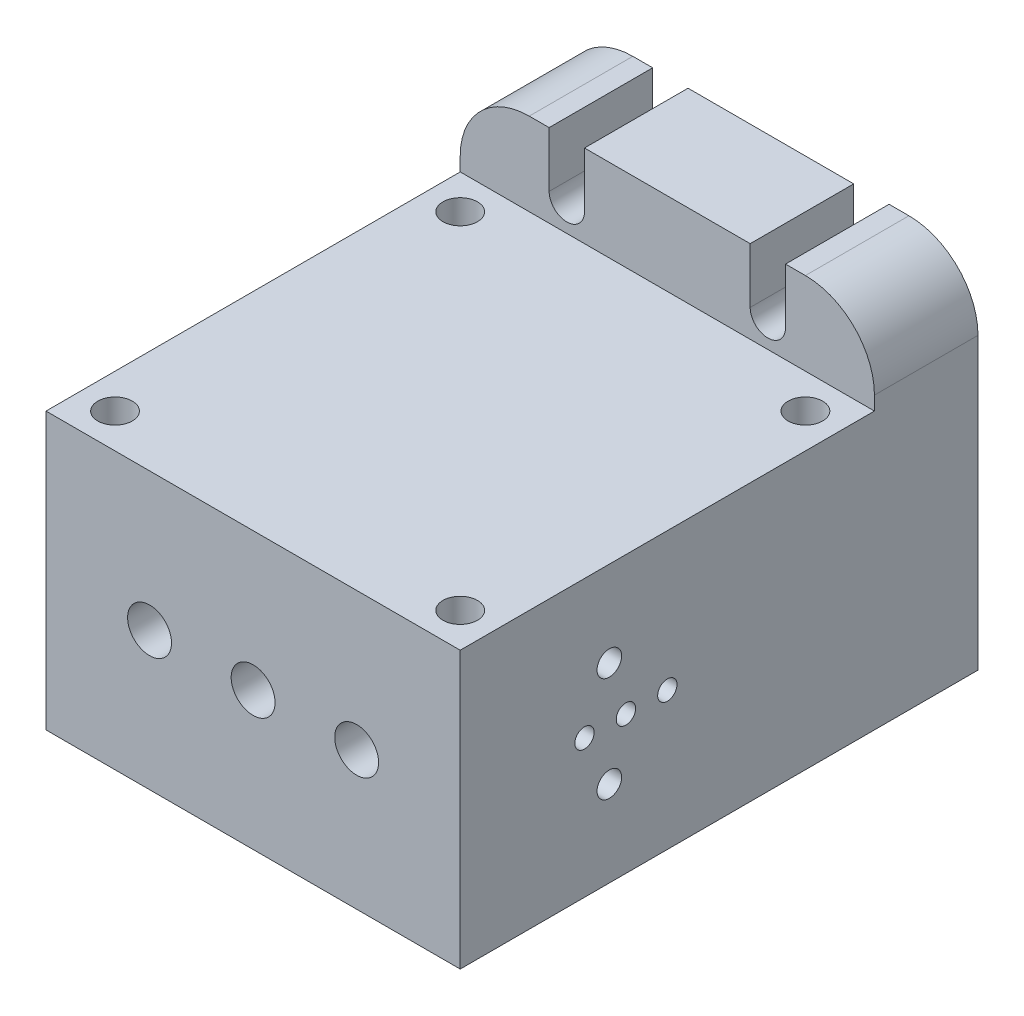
SolidWorks part; units mm, degrees
ref_plane "Front Plane" through (0, 0, 0) normal (0, 0, 1) x (1, 0, 0)
ref_plane "Top Plane" through (0, 0, 0) normal (0, 1, 0) x (1, 0, 0)
ref_plane "Right Plane" through (0, 0, 0) normal (1, 0, 0) x (0, 0, -1)
sketch "Sketch1" plane through (0, 0, 0) normal (0, 1, 0) x (1, 0, 0)
  line L1 (19.05, -19.05) -> (-19.05, -19.05)
  line L2 (19.05, -19.05) -> (19.05, 19.05)
  line L3 (19.05, 19.05) -> (-19.05, 19.05)
  line L4 (-19.05, -19.05) -> (-19.05, 19.05)
  line L5 (19.05, -19.05) -> (-19.05, 19.05) construction
  line L6 (19.05, 19.05) -> (-19.05, -19.05) construction
  point P0 (0, 0)
extrude "Boss-Extrude1" add sketch "Sketch1" along normal blind 25.4
sketch "Sketch43" plane through (0, 0, -19.05) normal (0, 0, -1) x (-1, 0, 0)
  line L0 (-19.05, 0) -> (19.05, 0) construction
  line L1 (19.05, 0) -> (-19.05, 0)
  line L2 (19.05, 0) -> (19.05, 25.4)
  line L3 (-19.05, 33.02) -> (19.05, 33.02)
  line L4 (-19.05, 0) -> (-19.05, 25.4)
  line L5 (19.05, 33.02) -> (19.05, 25.4)
  line L6 (-19.05, 33.02) -> (-19.05, 25.4)
  dimension "D1" = 38.1
  dimension "D2" = 7.62
hole_wizard "#50 (0.07) Diameter Hole1" positions "Sketch3" profile "Sketch2" hole size "#50" standard "Ansi Inch"
sketch "Sketch3" plane through (19.05, 0, 0) normal (1, 0, 0) x (0, 0, -1)
  point P0 (-3.81, 12.7)
sketch "Sketch2" plane through (19.05, 12.7, 3.81) normal (0, 1, 0) x (0, 0, -1)
  line L0 (0, 0) -> (0, 20.0922)
  line L1 (0, 20.0922) -> (0.889, 19.558)
  line L2 (0.889, 19.558) -> (0.889, 0)
  line L5 (0.889, 0) -> (0, 0)
  line L10 (0, 20.0922) -> (-0.889, 19.558) construction
  line L11 (0, -6.35) -> (0, 107.95) construction
  dimension "Hole Dia." = 1.778
  dimension "Hole Depth" = 19.558
  dimension "Drill Angle" = 118
hole_wizard "#50 (0.07) Diameter Hole2" positions "Sketch5" profile "Sketch4" hole size "#50" standard "Ansi Inch"
sketch "Sketch5" plane through (19.05, 0, 0) normal (1, 0, 0) x (0, 0, -1)
  point P0 (-7.62, 12.7)
sketch "Sketch4" plane through (19.05, 12.7, 7.62) normal (0, 1, 0) x (0, 0, -1)
  line L0 (0, 0) -> (0, 10.4402)
  line L1 (0, 10.4402) -> (0.889, 9.906)
  line L2 (0.889, 9.906) -> (0.889, 0)
  line L5 (0.889, 0) -> (0, 0)
  line L10 (0, 10.4402) -> (-0.889, 9.906) construction
  line L11 (0, -6.35) -> (0, 107.95) construction
  dimension "Hole Dia." = 1.778
  dimension "Hole Depth" = 9.906
  dimension "Drill Angle" = 118
hole_wizard "#50 (0.07) Diameter Hole3" positions "Sketch7" profile "Sketch6" hole size "#50" standard "Ansi Inch"
sketch "Sketch7" plane through (19.05, 0, 0) normal (1, 0, 0) x (0, 0, -1)
  point P0 (0, 12.7)
sketch "Sketch6" plane through (19.05, 12.7, 0) normal (0, 1, 0) x (0, 0, -1)
  line L0 (0, 0) -> (0, 38.1)
  line L1 (0, 38.1) -> (0.889, 38.1)
  line L2 (0.889, 38.1) -> (0.889, 0)
  line L5 (0.889, 0) -> (0, 0)
  line L11 (0, -6.35) -> (0, 107.95) construction
  dimension "Thru Hole Dia." = 1.778
  dimension "Thru Hole Depth" = 38.1
hole_wizard "#4-40 Tapped Hole1" positions "Sketch9" profile "Sketch8" tap size "#4-40" standard "Ansi Inch"
sketch "Sketch9" plane through (19.05, 0, 0) normal (1, 0, 0) x (0, 0, -1)
  point P0 (-5.334, 7.874)
sketch "Sketch8" plane through (19.05, 7.874, 5.334) normal (0, 1, 0) x (0, 0, -1)
  line L0 (0, 0) -> (0, 9.5692)
  line L1 (0, 9.5692) -> (1.1303, 8.89)
  line L2 (1.1303, 8.89) -> (1.1303, 0)
  line L5 (1.1303, 0) -> (0, 0)
  line L10 (0, 9.5692) -> (-1.1303, 8.89) construction
  line L11 (0, -6.35) -> (0, 107.95) construction
  dimension "Tap Drill Dia." = 2.2606
  dimension "Tap Drill Depth" = 8.89
  dimension "Drill Angle" = 118
hole_wizard "#4-40 Tapped Hole2" positions "Sketch11" profile "Sketch10" tap size "#4-40" standard "Ansi Inch"
sketch "Sketch11" plane through (19.05, 0, 0) normal (1, 0, 0) x (0, 0, -1)
  point P0 (-5.334, 17.526)
sketch "Sketch10" plane through (19.05, 17.526, 5.334) normal (0, 1, 0) x (0, 0, -1)
  line L0 (0, 0) -> (0, 9.5692)
  line L1 (0, 9.5692) -> (1.1303, 8.89)
  line L2 (1.1303, 8.89) -> (1.1303, 0)
  line L5 (1.1303, 0) -> (0, 0)
  line L10 (0, 9.5692) -> (-1.1303, 8.89) construction
  line L11 (0, -6.35) -> (0, 107.95) construction
  dimension "Tap Drill Dia." = 2.2606
  dimension "Tap Drill Depth" = 8.89
  dimension "Drill Angle" = 118
hole_wizard "#50 (0.07) Diameter Hole4" positions "Sketch13" profile "Sketch12" hole size "#50" standard "Ansi Inch"
sketch "Sketch13" plane through (0, 0, 19.05) normal (0, 0, 1) x (1, 0, 0)
  point P0 (9.525, 12.7)
sketch "Sketch12" plane through (9.525, 12.7, 19.05) normal (1, 0, 0) x (0, -1, 0)
  line L0 (0, 0) -> (0, 12.4722)
  line L1 (0, 12.4722) -> (0.889, 11.938)
  line L2 (0.889, 11.938) -> (0.889, 0)
  line L5 (0.889, 0) -> (0, 0)
  line L10 (0, 12.4722) -> (-0.889, 11.938) construction
  line L11 (0, -6.35) -> (0, 107.95) construction
  dimension "Hole Dia." = 1.778
  dimension "Hole Depth" = 11.938
  dimension "Drill Angle" = 118
hole_wizard "#50 (0.07) Diameter Hole5" positions "Sketch15" profile "Sketch14" hole size "#50" standard "Ansi Inch"
sketch "Sketch15" plane through (0, 0, 19.05) normal (0, 0, 1) x (1, 0, 0)
  point P0 (0, 12.7)
sketch "Sketch14" plane through (0, 12.7, 19.05) normal (1, 0, 0) x (0, -1, 0)
  line L0 (0, 0) -> (0, 16.2822)
  line L1 (0, 16.2822) -> (0.889, 15.748)
  line L2 (0.889, 15.748) -> (0.889, 0)
  line L5 (0.889, 0) -> (0, 0)
  line L10 (0, 16.2822) -> (-0.889, 15.748) construction
  line L11 (0, -6.35) -> (0, 107.95) construction
  dimension "Hole Dia." = 1.778
  dimension "Hole Depth" = 15.748
  dimension "Drill Angle" = 118
hole_wizard "#50 (0.07) Diameter Hole6" positions "Sketch17" profile "Sketch16" hole size "#50" standard "Ansi Inch"
sketch "Sketch17" plane through (-19.05, 0, 0) normal (-1, 0, 0) x (0, 0, 1)
  point P0 (3.81, 12.7)
sketch "Sketch16" plane through (-19.05, 12.7, 3.81) normal (0, 1, 0) x (0, 0, 1)
  line L0 (0, 0) -> (0, 10.6942)
  line L1 (0, 10.6942) -> (0.889, 10.16)
  line L2 (0.889, 10.16) -> (0.889, 0)
  line L5 (0.889, 0) -> (0, 0)
  line L10 (0, 10.6942) -> (-0.889, 10.16) construction
  line L11 (0, -6.35) -> (0, 107.95) construction
  dimension "Hole Dia." = 1.778
  dimension "Hole Depth" = 10.16
  dimension "Drill Angle" = 118
hole_wizard "#50 (0.07) Diameter Hole7" positions "Sketch19" profile "Sketch18" hole size "#50" standard "Ansi Inch"
sketch "Sketch19" plane through (0, 0, 19.05) normal (0, 0, 1) x (1, 0, 0)
  point P0 (-9.525, 12.7)
sketch "Sketch18" plane through (-9.525, 12.7, 19.05) normal (1, 0, 0) x (0, -1, 0)
  line L0 (0, 0) -> (0, 16.2822)
  line L1 (0, 16.2822) -> (0.889, 15.748)
  line L2 (0.889, 15.748) -> (0.889, 0)
  line L5 (0.889, 0) -> (0, 0)
  line L10 (0, 16.2822) -> (-0.889, 15.748) construction
  line L11 (0, -6.35) -> (0, 107.95) construction
  dimension "Hole Dia." = 1.778
  dimension "Hole Depth" = 15.748
  dimension "Drill Angle" = 118
hole_wizard "#50 (0.07) Diameter Hole8" positions "Sketch21" profile "Sketch20" hole size "#50" standard "Ansi Inch"
sketch "Sketch21" plane through (-19.05, 0, 0) normal (-1, 0, 0) x (0, 0, 1)
  point P0 (-3.81, 12.7)
sketch "Sketch20" plane through (-19.05, 12.7, -3.81) normal (0, 1, 0) x (0, 0, 1)
  line L0 (0, 0) -> (0, 20.0922)
  line L1 (0, 20.0922) -> (0.889, 19.558)
  line L2 (0.889, 19.558) -> (0.889, 0)
  line L5 (0.889, 0) -> (0, 0)
  line L10 (0, 20.0922) -> (-0.889, 19.558) construction
  line L11 (0, -6.35) -> (0, 107.95) construction
  dimension "Hole Dia." = 1.778
  dimension "Hole Depth" = 19.558
  dimension "Drill Angle" = 118
hole_wizard "#50 (0.07) Diameter Hole9" positions "Sketch23" profile "Sketch22" hole size "#50" standard "Ansi Inch"
sketch "Sketch23" plane through (0, 0, 0) normal (0, -1, 0) x (1, 0, 0)
  point P0 (0, -3.81)
sketch "Sketch22" plane through (0, 0, -3.81) normal (1, 0, 0) x (0, 0, -1)
  line L0 (0, 0) -> (0, 13.7422)
  line L1 (0, 13.7422) -> (0.889, 13.208)
  line L2 (0.889, 13.208) -> (0.889, 0)
  line L5 (0.889, 0) -> (0, 0)
  line L10 (0, 13.7422) -> (-0.889, 13.208) construction
  line L11 (0, -6.35) -> (0, 107.95) construction
  dimension "Hole Dia." = 1.778
  dimension "Hole Depth" = 13.208
  dimension "Drill Angle" = 118
hole_wizard "#4-40 Tapped Hole3" positions "Sketch25" profile "Sketch24" tap size "#4-40" standard "Ansi Inch"
sketch "Sketch25" plane through (-19.05, 0, 0) normal (-1, 0, 0) x (0, 0, 1)
  point P0 (1.524, 17.526)
sketch "Sketch24" plane through (-19.05, 17.526, 1.524) normal (0, 1, 0) x (0, 0, 1)
  line L0 (0, 0) -> (0, 9.5692)
  line L1 (0, 9.5692) -> (1.1303, 8.89)
  line L2 (1.1303, 8.89) -> (1.1303, 0)
  line L5 (1.1303, 0) -> (0, 0)
  line L10 (0, 9.5692) -> (-1.1303, 8.89) construction
  line L11 (0, -6.35) -> (0, 107.95) construction
  dimension "Tap Drill Dia." = 2.2606
  dimension "Tap Drill Depth" = 8.89
  dimension "Drill Angle" = 118
hole_wizard "#4-40 Tapped Hole4" positions "Sketch27" profile "Sketch26" tap size "#4-40" standard "Ansi Inch"
sketch "Sketch27" plane through (-19.05, 0, 0) normal (-1, 0, 0) x (0, 0, 1)
  point P0 (1.524, 7.874)
sketch "Sketch26" plane through (-19.05, 7.874, 1.524) normal (0, 1, 0) x (0, 0, 1)
  line L0 (0, 0) -> (0, 9.5692)
  line L1 (0, 9.5692) -> (1.1303, 8.89)
  line L2 (1.1303, 8.89) -> (1.1303, 0)
  line L5 (1.1303, 0) -> (0, 0)
  line L10 (0, 9.5692) -> (-1.1303, 8.89) construction
  line L11 (0, -6.35) -> (0, 107.95) construction
  dimension "Tap Drill Dia." = 2.2606
  dimension "Tap Drill Depth" = 8.89
  dimension "Drill Angle" = 118
hole_wizard "#10-32 Tapped Hole1" positions "Sketch29" profile "Sketch28" tap size "#10-32" standard "ANSI Inch"
sketch "Sketch29" plane through (0, 0, 19.05) normal (0, 0, 1) x (1, 0, 0)
  point P0 (-9.525, 12.7)
sketch "Sketch28" plane through (-9.525, 12.7, 19.05) normal (1, 0, 0) x (0, -1, 0)
  line L0 (0, 0) -> (0, 9.0873)
  line L1 (0, 9.0873) -> (2.0193, 7.874)
  line L2 (2.0193, 7.874) -> (2.0193, 0)
  line L5 (2.0193, 0) -> (0, 0)
  line L10 (0, 9.0873) -> (-2.0193, 7.874) construction
  line L11 (0, -6.35) -> (0, 107.95) construction
  dimension "Tap Drill Dia." = 4.0386
  dimension "Tap Drill Depth" = 7.874
  dimension "Drill Angle" = 118
hole_wizard "#10-32 Tapped Hole2" positions "Sketch31" profile "Sketch30" tap size "#10-32" standard "ANSI Inch"
sketch "Sketch31" plane through (0, 0, 19.05) normal (0, 0, 1) x (1, 0, 0)
  point P0 (0, 12.7)
sketch "Sketch30" plane through (0, 12.7, 19.05) normal (1, 0, 0) x (0, -1, 0)
  line L0 (0, 0) -> (0, 9.0873)
  line L1 (0, 9.0873) -> (2.0193, 7.874)
  line L2 (2.0193, 7.874) -> (2.0193, 0)
  line L5 (2.0193, 0) -> (0, 0)
  line L10 (0, 9.0873) -> (-2.0193, 7.874) construction
  line L11 (0, -6.35) -> (0, 107.95) construction
  dimension "Tap Drill Dia." = 4.0386
  dimension "Tap Drill Depth" = 7.874
  dimension "Drill Angle" = 118
hole_wizard "#10-32 Tapped Hole3" positions "Sketch33" profile "Sketch32" tap size "#10-32" standard "ANSI Inch"
sketch "Sketch33" plane through (0, 0, 19.05) normal (0, 0, 1) x (1, 0, 0)
  point P0 (9.525, 12.7)
sketch "Sketch32" plane through (9.525, 12.7, 19.05) normal (1, 0, 0) x (0, -1, 0)
  line L0 (0, 0) -> (0, 9.0873)
  line L1 (0, 9.0873) -> (2.0193, 7.874)
  line L2 (2.0193, 7.874) -> (2.0193, 0)
  line L5 (2.0193, 0) -> (0, 0)
  line L10 (0, 9.0873) -> (-2.0193, 7.874) construction
  line L11 (0, -6.35) -> (0, 107.95) construction
  dimension "Tap Drill Dia." = 4.0386
  dimension "Tap Drill Depth" = 7.874
  dimension "Drill Angle" = 118
hole_wizard "1/8 (0.125) Diameter Hole1" positions "Sketch35" profile "Sketch34" hole size "1/8" standard "Ansi Inch"
sketch "Sketch35" plane through (0, 0, 0) normal (0, -1, 0) x (1, 0, 0)
  point P0 (15.875, 15.875)
sketch "Sketch34" plane through (15.875, 0, 15.875) normal (1, 0, 0) x (0, 0, -1)
  line L0 (0, 0) -> (0, 25.4)
  line L1 (0, 25.4) -> (1.5875, 25.4)
  line L2 (1.5875, 25.4) -> (1.5875, 0)
  line L5 (1.5875, 0) -> (0, 0)
  line L11 (0, -6.35) -> (0, 107.95) construction
  dimension "Thru Hole Dia." = 3.175
  dimension "Thru Hole Depth" = 25.4
hole_wizard "1/8 (0.125) Diameter Hole2" positions "Sketch37" profile "Sketch36" hole size "1/8" standard "Ansi Inch"
sketch "Sketch37" plane through (0, 0, 0) normal (0, -1, 0) x (1, 0, 0)
  point P0 (-15.875, 15.875)
sketch "Sketch36" plane through (-15.875, 0, 15.875) normal (1, 0, 0) x (0, 0, -1)
  line L0 (0, 0) -> (0, 25.4)
  line L1 (0, 25.4) -> (1.5875, 25.4)
  line L2 (1.5875, 25.4) -> (1.5875, 0)
  line L5 (1.5875, 0) -> (0, 0)
  line L11 (0, -6.35) -> (0, 107.95) construction
  dimension "Thru Hole Dia." = 3.175
  dimension "Thru Hole Depth" = 25.4
hole_wizard "1/8 (0.125) Diameter Hole3" positions "Sketch39" profile "Sketch38" hole size "1/8" standard "Ansi Inch"
sketch "Sketch39" plane through (0, 0, 0) normal (0, -1, 0) x (1, 0, 0)
  point P0 (15.875, -15.875)
sketch "Sketch38" plane through (15.875, 0, -15.875) normal (1, 0, 0) x (0, 0, -1)
  line L0 (0, 0) -> (0, 25.4)
  line L1 (0, 25.4) -> (1.5875, 25.4)
  line L2 (1.5875, 25.4) -> (1.5875, 0)
  line L5 (1.5875, 0) -> (0, 0)
  line L11 (0, -6.35) -> (0, 107.95) construction
  dimension "Thru Hole Dia." = 3.175
  dimension "Thru Hole Depth" = 25.4
hole_wizard "1/8 (0.125) Diameter Hole4" positions "Sketch41" profile "Sketch40" hole size "1/8" standard "Ansi Inch"
sketch "Sketch41" plane through (0, 0, 0) normal (0, -1, 0) x (1, 0, 0)
  point P0 (-15.875, -15.875)
sketch "Sketch40" plane through (-15.875, 0, -15.875) normal (1, 0, 0) x (0, 0, -1)
  line L0 (0, 0) -> (0, 25.4)
  line L1 (0, 25.4) -> (1.5875, 25.4)
  line L2 (1.5875, 25.4) -> (1.5875, 0)
  line L5 (1.5875, 0) -> (0, 0)
  line L11 (0, -6.35) -> (0, 107.95) construction
  dimension "Thru Hole Dia." = 3.175
  dimension "Thru Hole Depth" = 25.4
sketch "Sketch42" plane through (0, 0, 0) normal (0, -1, 0) x (1, 0, 0)
  circle A0 centre (0, 0) radius 14.2875
  circle A1 centre (0, 0) radius 18.0975
extrude "Cut-Extrude1" cut sketch "Sketch42" against normal blind 2.54
extrude "Boss-Extrude2" add sketch "Sketch43" along normal blind 9.525
sketch "Sketch44" plane through (0, 0, -19.05) normal (0, 0, 1) x (1, 0, 0)
  line L0 (10.8712, 27.94) -> (7.62, 27.94) construction
  line L1 (-10.8712, 33.02) -> (-7.62, 33.02)
  line L2 (10.8712, 33.02) -> (7.62, 33.02)
  line L3 (-10.8712, 33.02) -> (-10.8712, 27.94)
  line L4 (-7.62, 33.02) -> (-7.62, 27.94)
  line L5 (-19.05, 33.02) -> (19.05, 33.02) construction
  line L6 (0, 33.02) -> (0, 25.4) construction
  line L7 (19.05, 25.4) -> (-19.05, 25.4) construction
  line L8 (7.62, 33.02) -> (7.62, 27.94)
  line L9 (10.8712, 33.02) -> (10.8712, 27.94)
  arc A0 (7.62, 27.94) -> (10.8712, 27.94) centre (9.2456, 27.94) ccw
  arc A1 (-7.62, 27.94) -> (-10.8712, 27.94) centre (-9.2456, 27.94) cw
  dimension "D3" = 3.2512
  dimension "D1" = 7.62
  dimension "D2" = 5.08
extrude "Cut-Extrude4" cut sketch "Sketch44" against normal up to next
fillet "Fillet1" radius 6.35 2 edges at (-19.05, 33.02, -23.8125) (19.05, 33.02, -23.8125)
